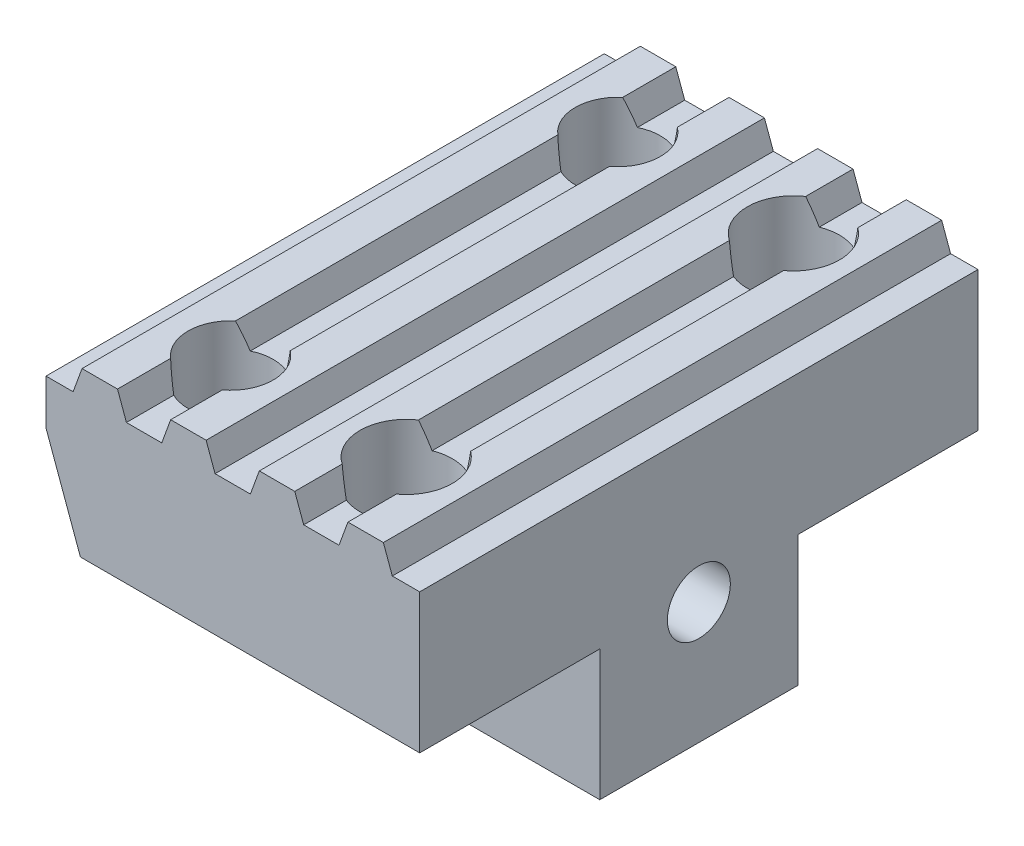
SolidWorks part; units mm, degrees
ref_plane "Front" through (0, 0, 0) normal (0, 0, 1) x (1, 0, 0)
ref_plane "Top" through (0, 0, 0) normal (0, 1, 0) x (1, 0, 0)
ref_plane "Right" through (0, 0, 0) normal (1, 0, 0) x (0, 0, -1)
sketch "Sketch1" plane through (0, 0, 0) normal (0, 0, 1) x (1, 0, 0)
  line L0 (0.762, -0.008) -> (1.0167, 0.692)
  line L1 (1.0167, 0.692) -> (2.0167, 0.692)
  line L2 (2.0167, 0.692) -> (2.2715, -0.008)
  line L3 (0.762, -0.008) -> (2.2715, -0.008)
  dimension "D1" = 110
  dimension "D2" = 110
  dimension "D3" = 1
  dimension "D4" = 0.7
  dimension "D5" = 0.762
extrude "Extrude1" add sketch "Sketch1" along normal blind 15.748
sketch "Sketch2" plane through (0, 0, 0) normal (0, 1, 0) x (1, 0, 0)
  line L0 (2.0167, -15.748) -> (1.0167, -15.748) construction
  line L1 (0, 0) -> (10.541, 0)
  line L2 (0, 0) -> (0, -15.748)
  line L3 (0, -15.748) -> (10.541, -15.748)
  line L4 (10.541, 0) -> (10.541, -15.748)
  dimension "D1" = 10.541
extrude "Extrude2" add sketch "Sketch2" against normal blind 7.62
pattern_linear "LPattern1" count 4 spacing 2.5 along (1, 0, 0) of "Extrude1"
hole_wizard "#32 (0.116) Diameter Hole1" positions "Sketch4" profile "Sketch3" hole size "#32" standard "Ansi Inch"
sketch "Sketch4" plane through (0, -7.62, 0) normal (0, -1, 0) x (1, 0, 0)
  line L1 (10.541, 0) -> (0.9652, 0) construction
  line L2 (10.541, 21.336) -> (10.541, 0) construction
  line L3 (0.9652, 21.336) -> (0.9652, 0) construction
  line L4 (0.9652, 21.336) -> (10.541, 21.336) construction
  point P0 (8.255, 2.794)
  point P1 (3.2512, 2.794)
  point P8 (8.255, 18.542)
  point P9 (3.2512, 18.542)
  dimension "D1" = 2.794
  dimension "D2" = 2.286
  dimension "D3" = 2.286
  dimension "D4" = 2.794
sketch "Sketch3" plane through (8.255, -7.62, 2.794) normal (1, 0, 0) x (0, 0, -1)
  line L0 (0, 0) -> (0, 8.3098)
  line L1 (0, 8.3098) -> (1.4732, 8.3098)
  line L2 (1.4732, 8.3098) -> (1.4732, 0)
  line L5 (1.4732, 0) -> (0, 0)
  line L11 (0, -6.35) -> (0, 107.95) construction
  dimension "Thru Hole Dia." = 2.9464
  dimension "Thru Hole Depth" = 8.3098
sketch "Sketch7" plane through (0, 0, 0) normal (0, 0, -1) x (-1, 0, 0)
  line L0 (0, -7.62) -> (0, -1.27)
  line L1 (0, -1.27) -> (-2.3112, -7.62)
  line L2 (-10.541, -7.62) -> (0, -7.62) construction
  line L3 (-2.3112, -7.62) -> (0, -7.62)
  dimension "D1" = 20
  dimension "D2" = 6.35
extrude "Cut-Extrude1" cut sketch "Sketch7" against normal through all
hole_wizard "3/32 LC2" positions "Sketch9" profile "Sketch8" hole size "3/32" standard "Ansi Inch"
sketch "Sketch9" plane through (0, 0.692, 0) normal (0, 1, 0) x (-1, 0, 0)
  line L0 (-2.0167, 15.748) -> (-1.0167, 15.748) construction
  line L1 (-2.0167, 0) -> (-1.0167, 0) construction
  line L2 (-3.2649, 0) -> (-2.2686, 0) construction
  line L3 (0, 0) -> (0, 15.748) construction
  point P0 (-2.794, 13.335)
  point P1 (-2.794, 2.413)
  dimension "D1" = 2.413
  dimension "D2" = 2.413
  dimension "D3" = 2.794
sketch "Sketch8" plane through (2.794, 0.692, 13.335) normal (1, 0, 0) x (0, 0, 1)
  line L0 (0, 0) -> (0, 8.312)
  line L1 (0, 8.312) -> (1.2001, 8.312)
  line L2 (1.2001, 8.312) -> (1.2001, 0)
  line L5 (1.2001, 0) -> (0, 0)
  line L11 (0, -6.35) -> (0, 107.95) construction
  dimension "Thru Hole Dia." = 2.4003
  dimension "Thru Hole Depth" = 8.312
sketch "Sketch10" plane through (10.541, 0, 0) normal (1, 0, 0) x (0, 0, -1)
  line L0 (-15.748, -7.62) -> (-15.748, 0) construction
  line L1 (-15.748, -3.9349) -> (-10.668, -3.9349)
  line L2 (-15.748, -3.9349) -> (-15.748, -7.62)
  line L3 (-15.748, -7.62) -> (-10.668, -7.62)
  line L4 (-10.668, -3.9349) -> (-10.668, -7.62)
  line L5 (-15.748, -7.62) -> (0, -7.62) construction
  line L6 (-10.668, -6.3479) -> (-10.668, -3.9349) construction
  line L7 (-10.668, -3.9349) -> (-15.748, -3.9349) construction
extrude "Cut-Extrude2" cut sketch "Sketch10" against normal through all
ref_plane "center" through (0, 0, 7.874) normal (0, 0, 1) x (1, 0, 0)
mirror "Mirror1" about plane through (0, 0, 7.874) normal (0, 0, 1) of "Cut-Extrude2"
hole_wizard "M2.6 (2.6) Diameter Hole1" positions "Sketch12" profile "Sketch11" hole size "M2.6" standard "Ansi Metric"
sketch "Sketch12" plane through (0, -3.9349, 0) normal (0, -1, 0) x (1, 0, 0)
  line L0 (10.541, 5.08) -> (10.541, 0) construction
  point P0 (7.747, 13.335)
  point P1 (7.747, 2.413)
  dimension "D1" = 2.794
sketch "Sketch11" plane through (7.747, -3.9349, 13.335) normal (1, 0, 0) x (0, 0, -1)
  line L0 (0, 0) -> (0, 4.6268)
  line L1 (0, 4.6268) -> (1.3, 4.6268)
  line L2 (1.3, 4.6268) -> (1.3, 0)
  line L5 (1.3, 0) -> (0, 0)
  line L11 (0, -6.35) -> (0, 107.95) construction
  dimension "Thru Hole Dia." = 2.6
  dimension "Thru Hole Depth" = 4.6268
fillet "Fillet1" radius 1.27 3 edges at (6.4261, -7.62, 10.668) (6.4261, -7.62, 5.08) (2.3112, -7.62, 7.874)
hole_wizard "#2-56 Tapped Hole1" positions "Sketch6" profile "Sketch5" tap size "#2-56" standard "Ansi Inch"
sketch "Sketch6" plane through (10.541, 0, 0) normal (1, 0, 0) x (0, 0, -1)
  circle A0 centre (-7.874, -4.1889) radius 1.1303 construction
  point P0 (-7.874, -4.1889)
sketch "Sketch5" plane through (10.541, -4.1889, 7.874) normal (0, 1, 0) x (0, 0, -1)
  line L0 (0, 0) -> (0, 7.206)
  line L1 (0, 7.206) -> (0.889, 7.206)
  line L2 (0.889, 7.206) -> (0.889, 0)
  line L5 (0.889, 0) -> (0, 0)
  line L10 (0, 7.206) -> (-0.889, 7.206) construction
  line L11 (0, -6.35) -> (0, 107.95) construction
  dimension "Tap Drill Dia." = 1.778
  dimension "Tap Drill Depth" = 7.206
  dimension "Drill Angle" = 180
